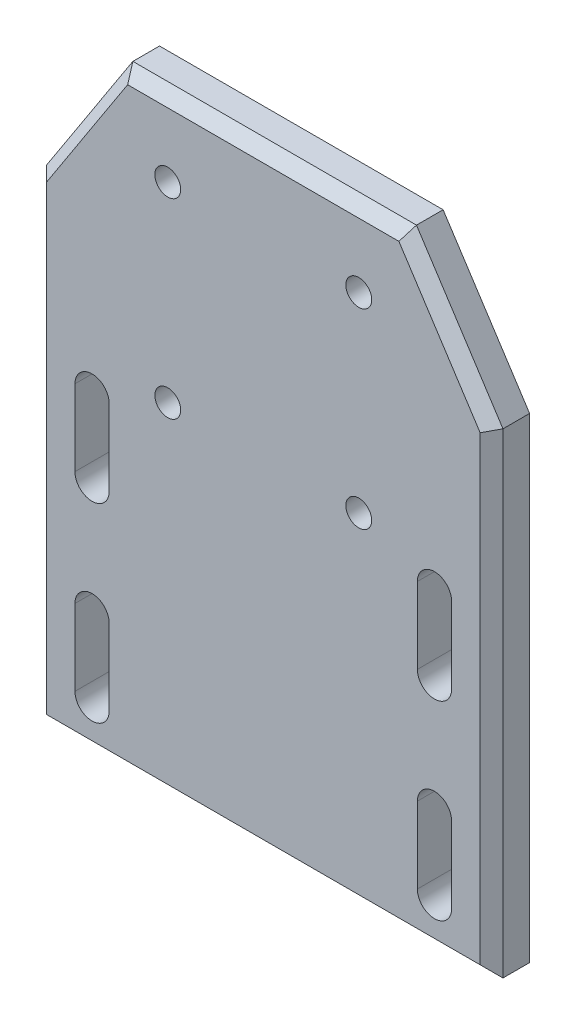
SolidWorks part; units mm, degrees
ref_plane "Plan de face" through (0, 0, 0) normal (0, 0, 1) x (1, 0, 0)
ref_plane "Plan de dessus" through (0, 0, 0) normal (0, 1, 0) x (1, 0, 0)
ref_plane "Plan de droite" through (0, 0, 0) normal (1, 0, 0) x (0, 0, -1)
sketch "Esquisse1" plane through (0, 0, 0) normal (0, 0, 1) x (1, 0, 0)
  line L0 (0, 69.6193) -> (0, -131.5914) construction
  line L1 (-88.9508, 0) -> (90.6946, 0) construction
  line L2 (-60, -115) -> (60, -115)
  line L3 (60, -115) -> (60, 10)
  line L4 (60, 10) -> (37.2707, 45)
  line L5 (37.2707, 45) -> (-37.2707, 45)
  line L6 (-37.2707, 45) -> (-60, 10)
  line L7 (-60, 10) -> (-60, -115)
  line L8 (-76.4652, -103) -> (-21.4204, -103) construction
  line L9 (-45, -75.9166) -> (-45, -134.7839) construction
  line L10 (-74.1717, -83) -> (-27.6661, -83) construction
  line L11 (-40.5, -83) -> (-40.5, -103)
  line L12 (-49.5, -83) -> (-49.5, -103)
  line L13 (-132.9333, -68) -> (73.2486, -68) construction
  line L14 (-49.5, -53) -> (-49.5, -33)
  line L15 (-40.5, -53) -> (-40.5, -33)
  line L16 (49.5, -83) -> (49.5, -103)
  line L17 (40.5, -83) -> (40.5, -103)
  line L18 (40.5, -53) -> (40.5, -33)
  line L19 (49.5, -53) -> (49.5, -33)
  arc A0 (-40.5, -83) -> (-49.5, -83) centre (-45, -83) ccw
  arc A1 (-49.5, -103) -> (-40.5, -103) centre (-45, -103) ccw
  arc A2 (-49.5, -33) -> (-40.5, -33) centre (-45, -33) cw
  arc A3 (-40.5, -53) -> (-49.5, -53) centre (-45, -53) cw
  arc A4 (49.5, -103) -> (40.5, -103) centre (45, -103) cw
  arc A5 (40.5, -83) -> (49.5, -83) centre (45, -83) cw
  arc A6 (40.5, -53) -> (49.5, -53) centre (45, -53) ccw
  arc A7 (49.5, -33) -> (40.5, -33) centre (45, -33) ccw
  dimension "D10" = 9
  dimension "D11" = 9
  dimension "D13" = 15
  dimension "D1" = 120
  dimension "D2" = 125
  dimension "D3" = 160
  dimension "D4" = 115
  dimension "D5" = 125
  dimension "D6" = 33
  dimension "D7" = 33
  dimension "D8" = 12
  dimension "D9" = 32
  dimension "D12" = 45
extrude "Extrusion1" add sketch "Esquisse1" along normal blind 10
hole_wizard "Trou taraudé M82" positions "Esquisse5" profile "Esquisse4" tap size "M8" standard "ISO"
sketch "Esquisse5" plane through (0, 0, 10) normal (0, 0, 1) x (1, 0, 0)
  line L0 (0, 54.5036) -> (0, -125.7192) construction
  line L2 (84.6409, 0) -> (-85.2487, 0) construction
  line L7 (-31.8295, 31.8295) -> (0, 0) construction
  line L8 (0, 0) -> (25.1023, 25.1023) construction
  circle A0 centre (0, 0) radius 35.5 construction
  point P0 (-25.1023, 25.1023)
  point P32 (25.1023, 25.1023)
  point P33 (25.1023, -25.1023)
  point P34 (-25.1023, -25.1023)
  dimension "D1" = 71
  dimension "D2" = 45
  dimension "D3" = 45
sketch "Esquisse4" plane through (-25.1023, 25.1023, 10) normal (1, 0, 0) x (0, -1, 0)
  line L0 (0, 0) -> (0, 24.2929)
  line L1 (0, 24.2929) -> (3.4, 22.25)
  line L2 (3.4, 22.25) -> (3.4, 0)
  line L5 (3.4, 0) -> (0, 0)
  line L10 (0, 24.2929) -> (-3.4, 22.25) construction
  line L11 (0, -6.35) -> (0, 107.95) construction
  dimension "Diamètre du trou pour taraudage" = 6.8
  dimension "Profondeur du trou pour taraudage" = 22.25
  dimension "Angle de pointe" = 118
chamfer "Chanfrein1" distance 3 angle 45 6 edges at (48.6354, 27.5, 10) (0, 45, 10) (-48.6354, 27.5, 10) (-60, -52.5, 10) (0, -115, 10) (60, -52.5, 10)
